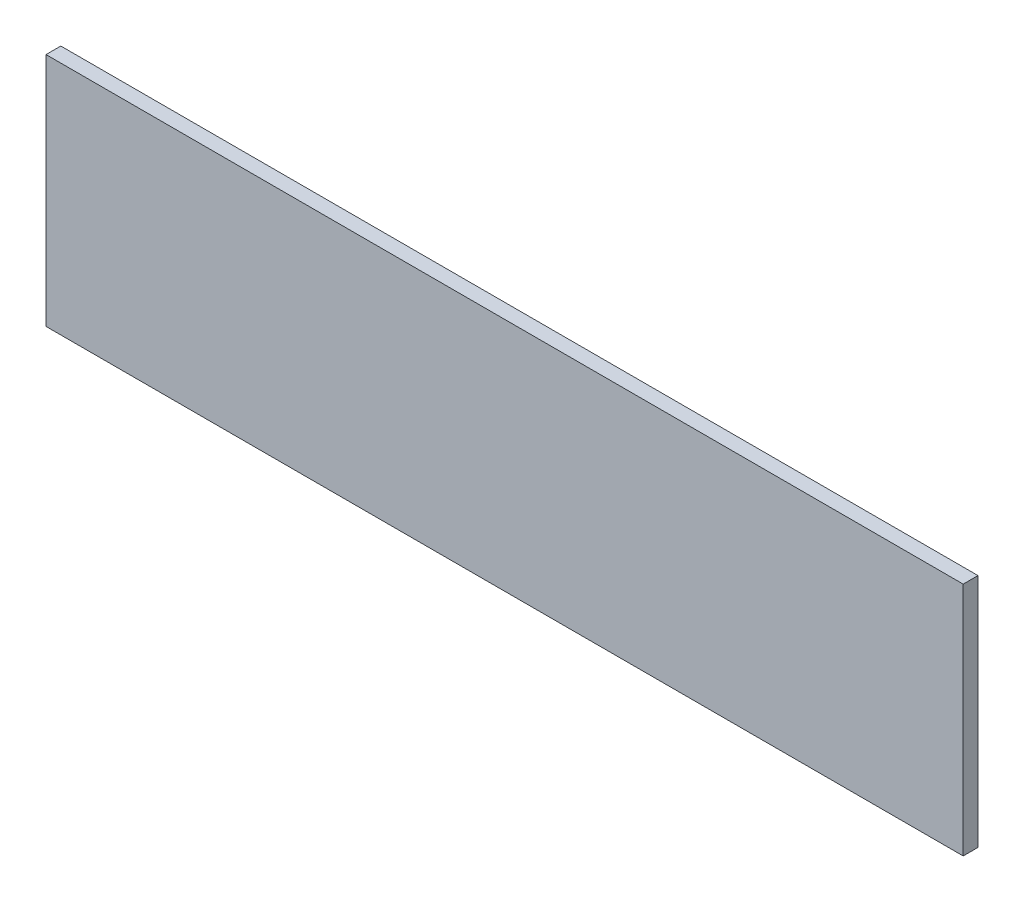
SolidWorks part; units mm, degrees
ref_plane "Front Plane" through (0, 0, 0) normal (0, 0, 1) x (1, 0, 0)
ref_plane "Top Plane" through (0, 0, 0) normal (0, 1, 0) x (1, 0, 0)
ref_plane "Right Plane" through (0, 0, 0) normal (1, 0, 0) x (0, 0, -1)
sketch "Sketch1" plane through (0, 0, 0) normal (0, 0, 1) x (1, 0, 0)
  line L1 (-590.55, -151.6063) -> (590.55, -151.6063)
  line L2 (-590.55, -151.6063) -> (-590.55, 151.6062)
  line L3 (-590.55, 151.6062) -> (590.55, 151.6062)
  line L4 (590.55, -151.6063) -> (590.55, 151.6062)
  line L5 (-590.55, -151.6063) -> (590.55, 151.6062) construction
  line L6 (-590.55, 151.6062) -> (590.55, -151.6063) construction
  point P0 (0, 0)
  dimension "D1" = 303.2125
  dimension "D2" = 1181.1
extrude "Extrude1" add sketch "Sketch1" along normal mid plane 19.05
